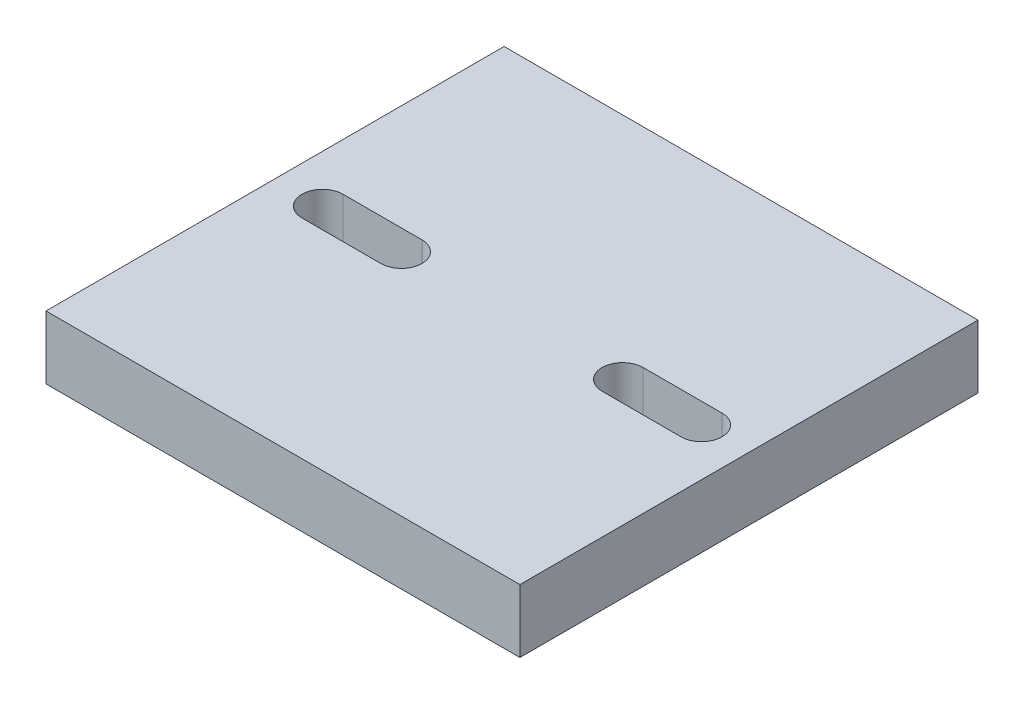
SolidWorks part; units mm, degrees
ref_plane "Спереди" through (0, 0, 0) normal (0, 0, 1) x (1, 0, 0)
ref_plane "Сверху" through (0, 0, 0) normal (0, 1, 0) x (1, 0, 0)
ref_plane "Справа" through (0, 0, 0) normal (1, 0, 0) x (0, 0, -1)
sketch "Эскиз2" plane through (0, 0, 0) normal (0, 0, 1) x (1, 0, 0)
  line L1 (-60, 0) -> (0, 0)
  line L2 (-60, 0) -> (-60, 8)
  line L3 (-60, 8) -> (0, 8)
  line L4 (0, 0) -> (0, 8)
  dimension "D1" = 8
  dimension "D2" = 60
extrude "Бобышка-Вытянуть2" add sketch "Эскиз2" along normal blind 58
sketch "Эскиз3" plane through (0, 8, 0) normal (0, 1, 0) x (1, 0, 0)
  line L1 (-54, -26.4) -> (-44, -26.4)
  line L2 (-60, -58) -> (-60, 0) construction
  line L3 (-54, -31.6) -> (-44, -31.6)
  line L4 (-60, -29) -> (50.7094, -29) construction
  line L5 (-60, -58) -> (-60, 0) construction
  line L6 (-30, -58) -> (-30, -17.0512) construction
  line L7 (0, -58) -> (-60, -58) construction
  line L8 (-6, -31.6) -> (-16, -31.6)
  line L9 (-6, -26.4) -> (-16, -26.4)
  arc A0 (-54, -26.4) -> (-54, -31.6) centre (-54, -29) ccw
  arc A1 (-44, -26.4) -> (-44, -31.6) centre (-44, -29) cw
  arc A2 (-16, -26.4) -> (-16, -31.6) centre (-16, -29) ccw
  arc A3 (-6, -26.4) -> (-6, -31.6) centre (-6, -29) cw
  dimension "D4" = 6
  dimension "D2" = 2.6
  dimension "D1" = 10
extrude "Вырез-Вытянуть1" cut sketch "Эскиз3" against normal through all
